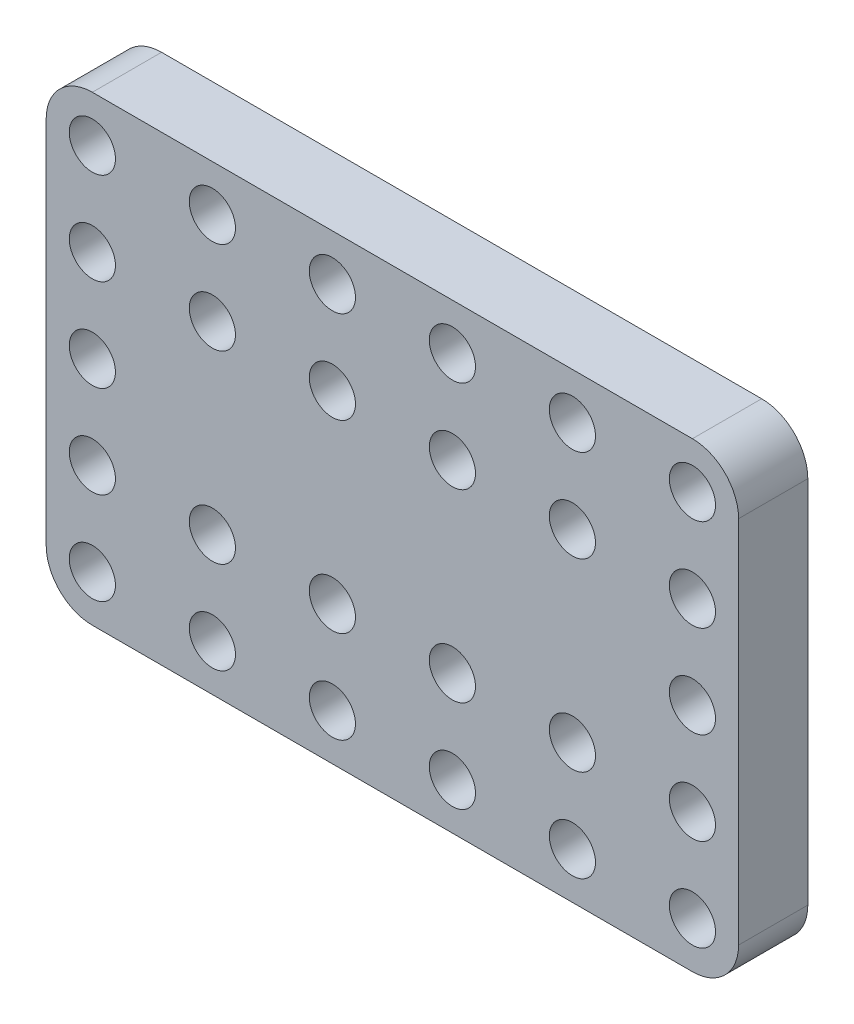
SolidWorks part; units mm, degrees
ref_plane "Front Plane" through (0, 0, 0) normal (0, 0, 1) x (1, 0, 0)
ref_plane "Top Plane" through (0, 0, 0) normal (0, 1, 0) x (1, 0, 0)
ref_plane "Right Plane" through (0, 0, 0) normal (1, 0, 0) x (0, 0, -1)
sketch "Sketch1" plane through (0, 0, 0) normal (0, 0, 1) x (1, 0, 0)
  line L0 (10, 10) -> (36, 10) construction
  line L1 (10, 0) -> (140, 0)
  line L2 (0, 10) -> (0, 90)
  line L3 (10, 100) -> (140, 100)
  line L4 (150, 10) -> (150, 90)
  line L5 (10, 10) -> (10, 30) construction
  arc A0 (0, 90) -> (10, 100) centre (10, 90) cw
  arc A1 (150, 90) -> (140, 100) centre (140, 90) ccw
  arc A2 (150, 10) -> (140, 0) centre (140, 10) cw
  arc A3 (0, 10) -> (10, 0) centre (10, 10) ccw
  circle A4 centre (10, 10) radius 5
  circle A34 centre (36, 10) radius 5
  circle A35 centre (62, 10) radius 5
  circle A36 centre (88, 10) radius 5
  circle A37 centre (114, 10) radius 5
  circle A38 centre (140, 10) radius 5
  circle A39 centre (10, 30) radius 5
  circle A40 centre (36, 30) radius 5
  circle A41 centre (62, 30) radius 5
  circle A42 centre (88, 30) radius 5
  circle A43 centre (114, 30) radius 5
  circle A44 centre (140, 30) radius 5
  circle A45 centre (10, 50) radius 5
  circle A50 centre (140, 50) radius 5
  circle A51 centre (10, 70) radius 5
  circle A52 centre (36, 70) radius 5
  circle A53 centre (62, 70) radius 5
  circle A54 centre (88, 70) radius 5
  circle A55 centre (114, 70) radius 5
  circle A56 centre (140, 70) radius 5
  circle A57 centre (10, 90) radius 5
  circle A58 centre (36, 90) radius 5
  circle A59 centre (62, 90) radius 5
  circle A60 centre (88, 90) radius 5
  circle A61 centre (114, 90) radius 5
  circle A62 centre (140, 90) radius 5
  circle A63 centre (36, 50) radius 5
  circle A64 centre (62, 50) radius 5
  circle A65 centre (88, 50) radius 5
  circle A66 centre (114, 50) radius 5
  point P7 (0, 100)
  point P12 (150, 0)
  point P15 (0, 0)
  dimension "D3" = 10
  dimension "D4" = 10
  dimension "D1" = 100
  dimension "D2" = 150
  dimension "D5" = 26
  dimension "D6" = 20
  dimension "D7" = 90
extrude "Extrude1" add sketch "Sketch1" along normal mid plane 15
